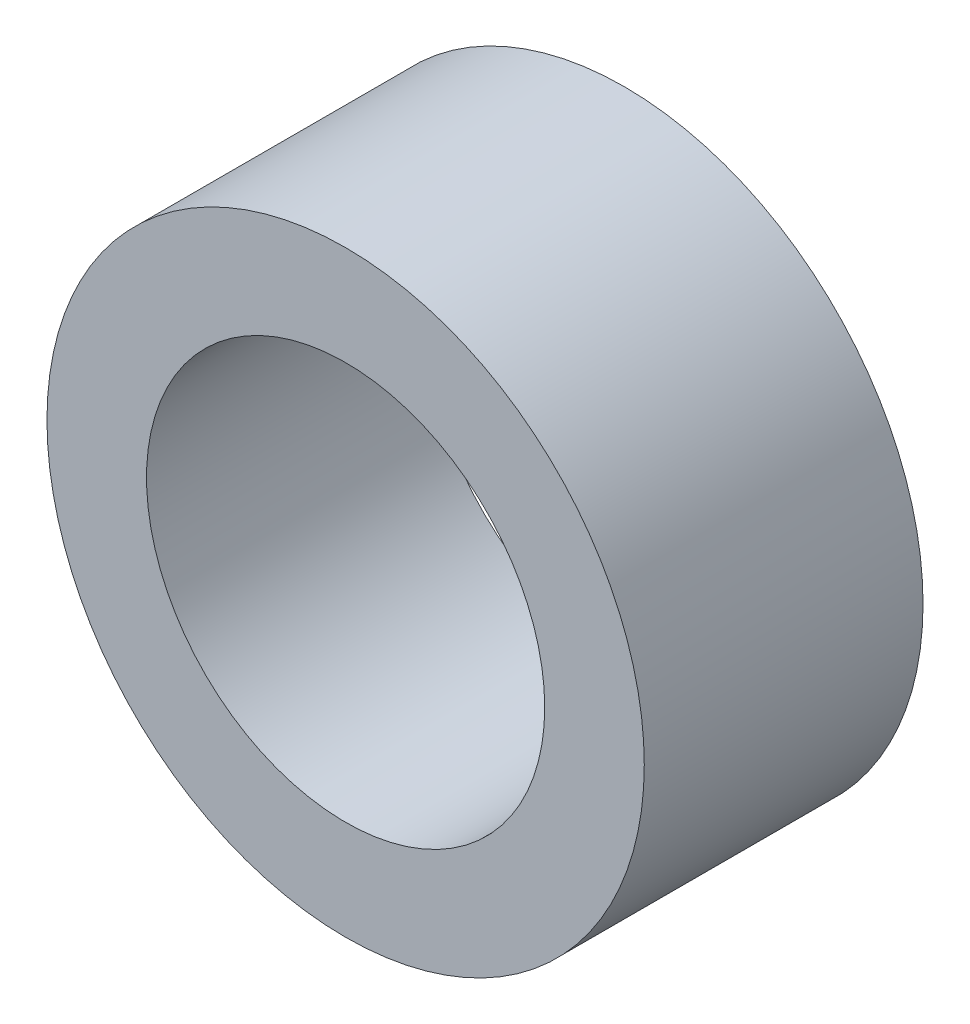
SolidWorks part; units mm, degrees
ref_plane "Front Plane" through (0, 0, 0) normal (0, 0, 1) x (1, 0, 0)
ref_plane "Top Plane" through (0, 0, 0) normal (0, 1, 0) x (1, 0, 0)
ref_plane "Right Plane" through (0, 0, 0) normal (1, 0, 0) x (0, 0, -1)
sketch "Sketch1" plane through (0, 0, 0) normal (0, 0, 1) x (1, 0, 0)
  circle A0 centre (0, 0) radius 30
  circle A1 centre (0, 0) radius 20
  dimension "D1" = 60
  dimension "D2" = 40
extrude "Boss-Extrude1" add sketch "Sketch1" along normal mid plane 28
